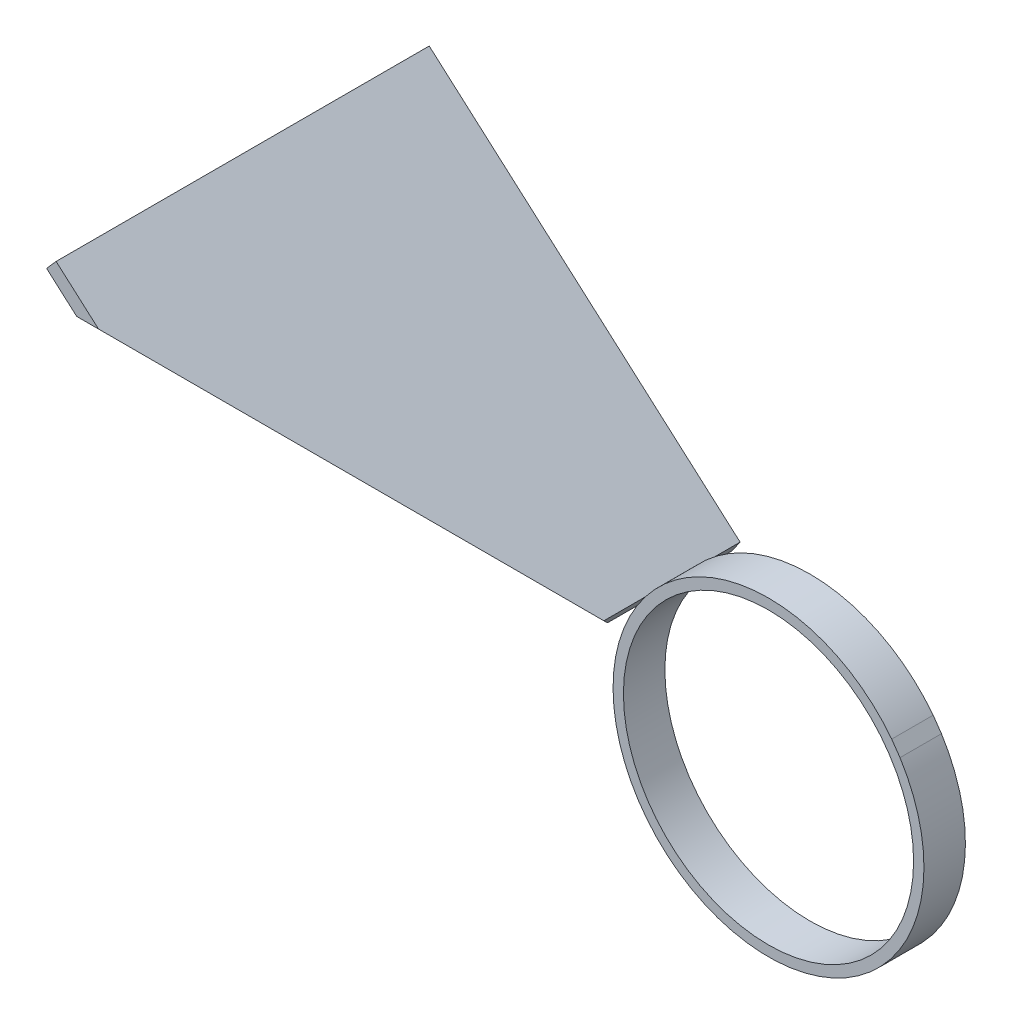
SolidWorks part; units mm, degrees
ref_plane "Front Plane" through (0, 0, 0) normal (0, 0, 1) x (1, 0, 0)
ref_plane "Top Plane" through (0, 0, 0) normal (0, 1, 0) x (1, 0, 0)
ref_plane "Right Plane" through (0, 0, 0) normal (1, 0, 0) x (0, 0, -1)
sketch "Sketch1" plane through (0, 0, 0) normal (0, 0, 1) x (1, 0, 0)
  circle A0 centre (0, 0) radius 37.5
  dimension "D1" = 75
extrude "Boss-Extrude1" add sketch "Sketch1" along normal blind 0.01
sketch "Sketch2" plane through (0, 0, 0.01) normal (0, 0, 1) x (1, 0, 0)
  circle A0 centre (0, 0) radius 35
  dimension "D1" = 70
extrude "Cut-Extrude1" cut sketch "Sketch2" against normal blind 10
sketch "Sketch5" plane through (0, 0, 0.01) normal (0, 0, 1) x (1, 0, 0)
  line L0 (29.7186, 22.8703) -> (104.7186, 89.0141)
  line L1 (104.7186, 89.0141) -> (107.0188, 86.406)
  line L2 (107.0188, 86.406) -> (31.7214, 20)
  line L3 (31.7214, 20) -> (29.7186, 22.8703)
  circle A0 centre (0, 0) radius 37.5 construction
  dimension "D1" = 100
  dimension "D2" = 3.5
  dimension "D3" = 75
  dimension "D4" = 20
extrude "Boss-Extrude2" add sketch "Sketch5" against normal mid plane 120
ref_plane "Plane1" through (107.0188, 0, 0) normal (1, 0, 0) x (0, 0, -1)
sketch "Sketch6" plane through (107.0188, 0, 0) normal (1, 0, 0) x (0, 0, -1)
  line L0 (-0.01, 20) -> (-60.01, 80)
  line L2 (-60.01, 80) -> (-60.01, 20)
  line L3 (-60.01, 20) -> (-0.01, 20)
  line L4 (-60.01, 20) -> (-60.01, 86.406) construction
  dimension "D1" = 60
extrude "Cut-Extrude2" cut sketch "Sketch6" against normal blind 100
sketch "Sketch7" plane through (107.0188, 0, 0) normal (1, 0, 0) x (0, 0, -1)
  line L0 (59.99, 20) -> (0, 20) construction
  line L3 (-0.01, 20) -> (29.99, 20) construction
  line L5 (29.99, 20) -> (59.99, 20)
  line L6 (29.99, 20) -> (29.99, 95)
  line L7 (29.99, 95) -> (59.99, 95)
  line L8 (59.99, 20) -> (59.99, 95)
  dimension "D1" = 30
  dimension "D2" = 75
  dimension "D3" = 30
extrude "Cut-Extrude3" cut sketch "Sketch7" against normal blind 100
ref_plane "Plane2" through (0, 0, -7.12) normal (0, 0, 1) x (1, 0, 0)
sketch "Sketch8" plane through (0, 0, -7.12) normal (0, 0, 1) x (1, 0, 0)
  circle A0 centre (0, 0) radius 37.5
  dimension "D1" = 75
extrude "Boss-Extrude3" add sketch "Sketch8" against normal blind 10
sketch "Sketch9" plane through (0, 0, -29.99) normal (0, 0, -1) x (-1, 0, 0)
  circle A0 centre (0, 0) radius 35
  dimension "D1" = 70
sketch "Sketch10" plane through (0, 0, 0.01) normal (0, 0, 1) x (1, 0, 0)
  circle A0 centre (0, 0) radius 37.5
  dimension "D1" = 75
extrude "Cut-Extrude4" cut sketch "Sketch10" against normal blind 3
sketch "Sketch11" plane through (0, 0, -7.12) normal (0, 0, 1) x (1, 0, 0)
  circle A0 centre (0, 0) radius 35
  dimension "D1" = 70
extrude "Cut-Extrude5" cut sketch "Sketch11" against normal through all
mirror "Mirror2" about plane through (0, 0, 0) normal (1, 0, 0) of "Cut-Extrude2", "Cut-Extrude3", "Boss-Extrude2"
sketch "Sketch12" plane through (0, 0, -7.12) normal (0, 0, 1) x (1, 0, 0)
  line L0 (31.7214, 20) -> (29.7186, 22.8703) construction
  line L4 (31.7214, 20) -> (29.7186, 22.8703)
  line L8 (29.7186, 22.8703) -> (24.124, 51.8446)
  line L9 (24.124, 51.8446) -> (102.3252, 101.2132)
  line L10 (102.3252, 101.2132) -> (122.6447, 72.4706)
  line L11 (122.6447, 72.4706) -> (133.4509, 16.5063)
  line L12 (133.4509, 16.5063) -> (47.9662, 0)
  line L13 (47.9662, 0) -> (31.7214, 20)
  arc A0 (29.7186, 22.8703) -> (-29.7186, 22.8703) centre (0, 0) ccw construction
  dimension "D1" = 85.4847
  dimension "D2" = 55.9643
  dimension "D3" = 28.7427
  dimension "D4" = 92.4808
  dimension "D5" = 33.5156
  dimension "D6" = 25.7661
  dimension "D7" = 37.232
  dimension "D8" = 78.2012
extrude "Cut-Extrude6" cut sketch "Sketch12" along normal through all
sketch "Sketch13" plane through (0, 0, -7.12) normal (0, 0, 1) x (1, 0, 0)
  line L0 (31.7214, 20) -> (29.7186, 22.8703)
  line L1 (29.7186, 22.8703) -> (104.7186, 89.0141)
  line L2 (104.7186, 89.0141) -> (107.0188, 86.406)
  line L3 (107.0188, 86.406) -> (31.7214, 20)
extrude "Cut-Extrude7" cut sketch "Sketch13" against normal through all
